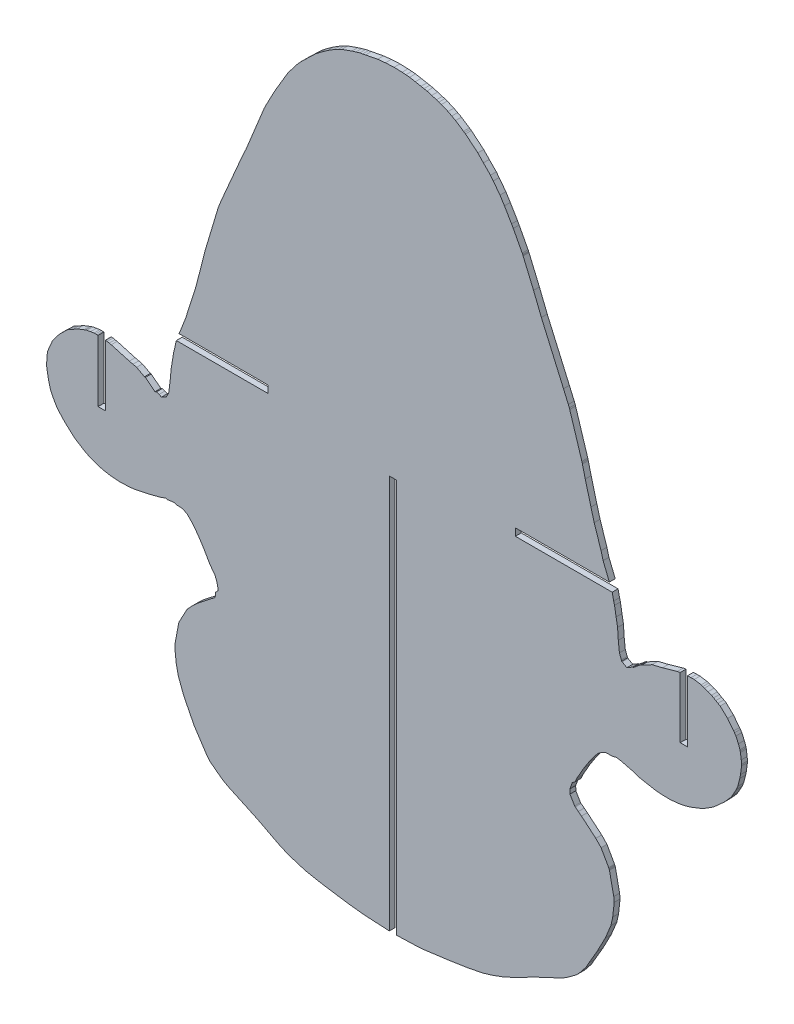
SolidWorks part; units mm, degrees
ref_plane "Спереди" through (0, 0, 0) normal (0, 0, 1) x (1, 0, 0)
ref_plane "Сверху" through (0, 0, 0) normal (0, 1, 0) x (1, 0, 0)
ref_plane "Справа" through (0, 0, 0) normal (1, 0, 0) x (0, 0, -1)
sketch "Model" plane through (0, 0, 0) normal (0, 0, 1) x (1, 0, 0)
  line L0 (-4539.2097, -790.8578) -> (-4543.2316, -789.8734)
  line L1 (-4543.2316, -789.8734) -> (-4543.8733, -789.7726)
  line L2 (-4543.8733, -789.7726) -> (-4544.515, -789.6715)
  line L3 (-4544.515, -789.6715) -> (-4545.1657, -789.8214)
  line L4 (-4545.1657, -789.8214) -> (-4545.8165, -789.9716)
  line L5 (-4545.8165, -789.9716) -> (-4546.9584, -790.0294)
  line L6 (-4546.9584, -790.0294) -> (-4548.1003, -790.0876)
  line L7 (-4548.1003, -790.0876) -> (-4548.5258, -790.1515)
  line L8 (-4548.5258, -790.1515) -> (-4550.4754, -791.2985)
  line L9 (-4550.4754, -791.2985) -> (-4551.1526, -792.0378)
  line L10 (-4551.1526, -792.0378) -> (-4551.8298, -792.7768)
  line L11 (-4551.8298, -792.7768) -> (-4553.8655, -795.6481)
  line L12 (-4553.8655, -795.6481) -> (-4555.4986, -798.1437)
  line L13 (-4555.4986, -798.1437) -> (-4557.9984, -802.5048)
  line L14 (-4557.9984, -802.5048) -> (-4558.2972, -803.1813)
  line L15 (-4558.2972, -803.1813) -> (-4558.596, -803.8581)
  line L16 (-4558.596, -803.8581) -> (-4559.0841, -804.2336)
  line L17 (-4559.0841, -804.2336) -> (-4559.5722, -804.6093)
  line L18 (-4559.5722, -804.6093) -> (-4560.4169, -806.8874)
  line L19 (-4560.4169, -806.8874) -> (-4560.3701, -808.4098)
  line L20 (-4560.3701, -808.4098) -> (-4558.763, -811.1066)
  line L21 (-4558.763, -811.1066) -> (-4558.5805, -811.2975)
  line L22 (-4558.5805, -811.2975) -> (-4557.519, -812.1125)
  line L23 (-4557.519, -812.1125) -> (-4556.4575, -812.9272)
  line L24 (-4556.4575, -812.9272) -> (-4551.5788, -817.047)
  line L25 (-4551.5788, -817.047) -> (-4549.7786, -818.9108)
  line L26 (-4549.7786, -818.9108) -> (-4547.1777, -823.4889)
  line L27 (-4547.1777, -823.4889) -> (-4547.1041, -823.6569)
  line L28 (-4547.1041, -823.6569) -> (-4547.0306, -823.8246)
  line L29 (-4547.0306, -823.8246) -> (-4547.0128, -823.8654)
  line L30 (-4547.0128, -823.8654) -> (-4546.9951, -823.9059)
  line L31 (-4546.9951, -823.9059) -> (-4546.959, -824.0324)
  line L32 (-4546.959, -824.0324) -> (-4546.923, -824.1591)
  line L33 (-4546.923, -824.1591) -> (-4545.4544, -831.1642)
  line L34 (-4545.4544, -831.1642) -> (-4545.301, -832.8083)
  line L35 (-4545.301, -832.8083) -> (-4545.8082, -837.4057)
  line L36 (-4545.8082, -837.4057) -> (-4546.3854, -840.1383)
  line L37 (-4546.3854, -840.1383) -> (-4548.3282, -844.8258)
  line L38 (-4548.3282, -844.8258) -> (-4551.1271, -850.1918)
  line L39 (-4551.1271, -850.1918) -> (-4553.9501, -855.0246)
  line L40 (-4553.9501, -855.0246) -> (-4554.9565, -856.8376)
  line L41 (-4554.9565, -856.8376) -> (-4557.1746, -859.6056)
  line L42 (-4557.1746, -859.6056) -> (-4558.1649, -860.6364)
  line L43 (-4558.1649, -860.6364) -> (-4561.2219, -862.8742)
  line L44 (-4561.2219, -862.8742) -> (-4562.2226, -863.5182)
  line L45 (-4562.2226, -863.5182) -> (-4563.5665, -864.2628)
  line L46 (-4563.5665, -864.2628) -> (-4572.4068, -868.4179)
  line L47 (-4572.4068, -868.4179) -> (-4579.4051, -872.0412)
  line L48 (-4579.4051, -872.0412) -> (-4583.5673, -873.8878)
  line L49 (-4583.5673, -873.8878) -> (-4586.6701, -875.0216)
  line L50 (-4586.6701, -875.0216) -> (-4590.0086, -876.0465)
  line L51 (-4590.0086, -876.0465) -> (-4595.1373, -877.0517)
  line L52 (-4595.1373, -877.0517) -> (-4600.9925, -877.9701)
  line L53 (-4600.9925, -877.9701) -> (-4609.15, -879.049)
  line L54 (-4609.15, -879.049) -> (-4610.9169, -879.2638)
  line L55 (-4610.9169, -879.2638) -> (-4612.9695, -879.3737)
  line L56 (-4612.9695, -879.3737) -> (-4619.0279, -879.5702)
  line L57 (-4619.0279, -879.5702) -> (-4619.3456, -879.5934)
  line L58 (-4619.3456, -879.5934) -> (-4619.4133, -879.5984)
  line L59 (-4619.4133, -879.5984) -> (-4619.4133, -745.3183)
  line L60 (-4619.4133, -745.3183) -> (-4619.6634, -745.3183)
  line L61 (-4619.6634, -745.3183) -> (-4621.6634, -745.3183)
  line L62 (-4621.6634, -745.3183) -> (-4621.9133, -745.3183)
  line L63 (-4621.9133, -745.3183) -> (-4621.9133, -879.5572)
  line L64 (-4621.9133, -879.5572) -> (-4630.3521, -879.0929)
  line L65 (-4630.3521, -879.0929) -> (-4635.1501, -878.5636)
  line L66 (-4635.1501, -878.5636) -> (-4637.3957, -878.2477)
  line L67 (-4637.3957, -878.2477) -> (-4639.6413, -877.932)
  line L68 (-4639.6413, -877.932) -> (-4645.7078, -876.9806)
  line L69 (-4645.7078, -876.9806) -> (-4650.7294, -875.9928)
  line L70 (-4650.7294, -875.9928) -> (-4654.4396, -874.8361)
  line L71 (-4654.4396, -874.8361) -> (-4655.8, -874.3561)
  line L72 (-4655.8, -874.3561) -> (-4657.1605, -873.8764)
  line L73 (-4657.1605, -873.8764) -> (-4658.3128, -873.3708)
  line L74 (-4658.3128, -873.3708) -> (-4659.4651, -872.8654)
  line L75 (-4659.4651, -872.8654) -> (-4666.7346, -869.081)
  line L76 (-4666.7346, -869.081) -> (-4676.6673, -864.4753)
  line L77 (-4676.6673, -864.4753) -> (-4678.3129, -863.5622)
  line L78 (-4678.3129, -863.5622) -> (-4679.6122, -862.6881)
  line L79 (-4679.6122, -862.6881) -> (-4683.022, -860.0951)
  line L80 (-4683.022, -860.0951) -> (-4683.4616, -859.571)
  line L81 (-4683.4616, -859.571) -> (-4683.9012, -859.047)
  line L82 (-4683.9012, -859.047) -> (-4688.2785, -852.4176)
  line L83 (-4688.2785, -852.4176) -> (-4689.7039, -849.6376)
  line L84 (-4689.7039, -849.6376) -> (-4692.0418, -844.9523)
  line L85 (-4692.0418, -844.9523) -> (-4693.7796, -840.3092)
  line L86 (-4693.7796, -840.3092) -> (-4694.4931, -836.9772)
  line L87 (-4694.4931, -836.9772) -> (-4694.973, -832.7043)
  line L88 (-4694.973, -832.7043) -> (-4694.8629, -831.0016)
  line L89 (-4694.8629, -831.0016) -> (-4693.6779, -824.6508)
  line L90 (-4693.6779, -824.6508) -> (-4693.6454, -824.5343)
  line L91 (-4693.6454, -824.5343) -> (-4693.613, -824.4176)
  line L92 (-4693.613, -824.4176) -> (-4693.5715, -824.3302)
  line L93 (-4693.5715, -824.3302) -> (-4693.4359, -823.9987)
  line L94 (-4693.4359, -823.9987) -> (-4691.07, -819.6042)
  line L95 (-4691.07, -819.6042) -> (-4690.8127, -819.0783)
  line L96 (-4690.8127, -819.0783) -> (-4690.1152, -818.3302)
  line L97 (-4690.1152, -818.3302) -> (-4689.4178, -817.5819)
  line L98 (-4689.4178, -817.5819) -> (-4687.2056, -815.477)
  line L99 (-4687.2056, -815.477) -> (-4681.2269, -810.8229)
  line L100 (-4681.2269, -810.8229) -> (-4681.1719, -809.2943)
  line L101 (-4681.1719, -809.2943) -> (-4680.7441, -808.8463)
  line L102 (-4680.7441, -808.8463) -> (-4680.3163, -808.3986)
  line L103 (-4680.3163, -808.3986) -> (-4680.2519, -808.1667)
  line L104 (-4680.2519, -808.1667) -> (-4680.1874, -807.9345)
  line L105 (-4680.1874, -807.9345) -> (-4680.7082, -805.8615)
  line L106 (-4680.7082, -805.8615) -> (-4681.2849, -804.2648)
  line L107 (-4681.2849, -804.2648) -> (-4682.957, -802.0836)
  line L108 (-4682.957, -802.0836) -> (-4685.1479, -798.2858)
  line L109 (-4685.1479, -798.2858) -> (-4687.1816, -795.1496)
  line L110 (-4687.1816, -795.1496) -> (-4689.3422, -792.4276)
  line L111 (-4689.3422, -792.4276) -> (-4690.0955, -791.6798)
  line L112 (-4690.0955, -791.6798) -> (-4690.8487, -790.9323)
  line L113 (-4690.8487, -790.9323) -> (-4691.6077, -790.5685)
  line L114 (-4691.6077, -790.5685) -> (-4692.3666, -790.205)
  line L115 (-4692.3666, -790.205) -> (-4694.4406, -790.0648)
  line L116 (-4694.4406, -790.0648) -> (-4695.4153, -789.7733)
  line L117 (-4695.4153, -789.7733) -> (-4697.5311, -790.1068)
  line L118 (-4697.5311, -790.1068) -> (-4698.1468, -789.9189)
  line L119 (-4698.1468, -789.9189) -> (-4699.4107, -790.4555)
  line L120 (-4699.4107, -790.4555) -> (-4701.2761, -790.946)
  line L121 (-4701.2761, -790.946) -> (-4703.1414, -791.4367)
  line L122 (-4703.1414, -791.4367) -> (-4706.1068, -792.0744)
  line L123 (-4706.1068, -792.0744) -> (-4708.9947, -792.6867)
  line L124 (-4708.9947, -792.6867) -> (-4711.1729, -792.8605)
  line L125 (-4711.1729, -792.8605) -> (-4714.1107, -792.9596)
  line L126 (-4714.1107, -792.9596) -> (-4716.4146, -792.7702)
  line L127 (-4716.4146, -792.7702) -> (-4719.1192, -792.3566)
  line L128 (-4719.1192, -792.3566) -> (-4720.6899, -791.9245)
  line L129 (-4720.6899, -791.9245) -> (-4722.1376, -791.4088)
  line L130 (-4722.1376, -791.4088) -> (-4723.5853, -790.8935)
  line L131 (-4723.5853, -790.8935) -> (-4724.2835, -790.5841)
  line L132 (-4724.2835, -790.5841) -> (-4724.9818, -790.2751)
  line L133 (-4724.9818, -790.2751) -> (-4725.7415, -789.8307)
  line L134 (-4725.7415, -789.8307) -> (-4726.5013, -789.3861)
  line L135 (-4726.5013, -789.3861) -> (-4729.0214, -787.7963)
  line L136 (-4729.0214, -787.7963) -> (-4730.4988, -786.5092)
  line L137 (-4730.4988, -786.5092) -> (-4732.5521, -784.6322)
  line L138 (-4732.5521, -784.6322) -> (-4734.8056, -782.1642)
  line L139 (-4734.8056, -782.1642) -> (-4735.1845, -781.6671)
  line L140 (-4735.1845, -781.6671) -> (-4735.3141, -781.4503)
  line L141 (-4735.3141, -781.4503) -> (-4735.4438, -781.2333)
  line L142 (-4735.4438, -781.2333) -> (-4736.9827, -778.4372)
  line L143 (-4736.9827, -778.4372) -> (-4737.3951, -777.4088)
  line L144 (-4737.3951, -777.4088) -> (-4738.0706, -774.7426)
  line L145 (-4738.0706, -774.7426) -> (-4738.3677, -773.1271)
  line L146 (-4738.3677, -773.1271) -> (-4738.6981, -770.9513)
  line L147 (-4738.6981, -770.9513) -> (-4738.5649, -769.0597)
  line L148 (-4738.5649, -769.0597) -> (-4738.3914, -766.9027)
  line L149 (-4738.3914, -766.9027) -> (-4738.3635, -766.7851)
  line L150 (-4738.3635, -766.7851) -> (-4738.2314, -766.4718)
  line L151 (-4738.2314, -766.4718) -> (-4738.0994, -766.1588)
  line L152 (-4738.0994, -766.1588) -> (-4736.7261, -762.9198)
  line L153 (-4736.7261, -762.9198) -> (-4736.5427, -762.6198)
  line L154 (-4736.5427, -762.6198) -> (-4736.3593, -762.32)
  line L155 (-4736.3593, -762.32) -> (-4734.7241, -760.1786)
  line L156 (-4734.7241, -760.1786) -> (-4734.2527, -759.6584)
  line L157 (-4734.2527, -759.6584) -> (-4733.7813, -759.1378)
  line L158 (-4733.7813, -759.1378) -> (-4731.4046, -756.8715)
  line L159 (-4731.4046, -756.8715) -> (-4730.5877, -756.4313)
  line L160 (-4730.5877, -756.4313) -> (-4729.7708, -755.9909)
  line L161 (-4729.7708, -755.9909) -> (-4728.1934, -755.067)
  line L162 (-4728.1934, -755.067) -> (-4725.9476, -754.1979)
  line L163 (-4725.9476, -754.1979) -> (-4725.4336, -754.0172)
  line L164 (-4725.4336, -754.0172) -> (-4724.9196, -753.8368)
  line L165 (-4724.9196, -753.8368) -> (-4723.7178, -753.6364)
  line L166 (-4723.7178, -753.6364) -> (-4722.5159, -753.4362)
  line L167 (-4722.5159, -753.4362) -> (-4722.0008, -753.4425)
  line L168 (-4722.0008, -753.4425) -> (-4721.4857, -753.4486)
  line L169 (-4721.4857, -753.4486) -> (-4721.1865, -753.446)
  line L170 (-4721.1865, -753.446) -> (-4721.1372, -753.4455)
  line L171 (-4721.1372, -753.4455) -> (-4721.1372, -774.4633)
  line L172 (-4721.1372, -774.4633) -> (-4720.8873, -774.4633)
  line L173 (-4720.8873, -774.4633) -> (-4718.8873, -774.4633)
  line L174 (-4718.8873, -774.4633) -> (-4718.6372, -774.4633)
  line L175 (-4718.6372, -774.4633) -> (-4718.6372, -753.6093)
  line L176 (-4718.6372, -753.6093) -> (-4718.4631, -753.633)
  line L177 (-4718.4631, -753.633) -> (-4718.039, -753.6903)
  line L178 (-4718.039, -753.6903) -> (-4717.342, -753.8302)
  line L179 (-4717.342, -753.8302) -> (-4716.6451, -753.9704)
  line L180 (-4716.6451, -753.9704) -> (-4710.4953, -755.7179)
  line L181 (-4710.4953, -755.7179) -> (-4709.2588, -756.0133)
  line L182 (-4709.2588, -756.0133) -> (-4708.0223, -756.309)
  line L183 (-4708.0223, -756.309) -> (-4705.3383, -757.7563)
  line L184 (-4705.3383, -757.7563) -> (-4705.0314, -757.7939)
  line L185 (-4705.0314, -757.7939) -> (-4701.7507, -760.3795)
  line L186 (-4701.7507, -760.3795) -> (-4701.2244, -760.151)
  line L187 (-4701.2244, -760.151) -> (-4700.371, -760.4977)
  line L188 (-4700.371, -760.4977) -> (-4699.5176, -760.8441)
  line L189 (-4699.5176, -760.8441) -> (-4698.6953, -760.3864)
  line L190 (-4698.6953, -760.3864) -> (-4697.873, -759.9289)
  line L191 (-4697.873, -759.9289) -> (-4697.0792, -758.506)
  line L192 (-4697.0792, -758.506) -> (-4696.5532, -754.2253)
  line L193 (-4696.5532, -754.2253) -> (-4696.2469, -750.9357)
  line L194 (-4696.2469, -750.9357) -> (-4695.8832, -748.6842)
  line L195 (-4695.8832, -748.6842) -> (-4695.3497, -745.4181)
  line L196 (-4695.3497, -745.4181) -> (-4695.1386, -744.6628)
  line L197 (-4695.1386, -744.6628) -> (-4694.481, -741.6415)
  line L198 (-4694.481, -741.6415) -> (-4663.1755, -741.6415)
  line L199 (-4663.1755, -741.6415) -> (-4663.1755, -741.3915)
  line L200 (-4663.1755, -741.3915) -> (-4663.1755, -739.3915)
  line L201 (-4663.1755, -739.3915) -> (-4663.1755, -739.1415)
  line L202 (-4663.1755, -739.1415) -> (-4693.5545, -739.1415)
  line L203 (-4693.5545, -739.1415) -> (-4692.8851, -737.5402)
  line L204 (-4692.8851, -737.5402) -> (-4691.0186, -732.7296)
  line L205 (-4691.0186, -732.7296) -> (-4690.9567, -732.5036)
  line L206 (-4690.9567, -732.5036) -> (-4690.8948, -732.2777)
  line L207 (-4690.8948, -732.2777) -> (-4690.855, -732.0988)
  line L208 (-4690.855, -732.0988) -> (-4690.8152, -731.9196)
  line L209 (-4690.8152, -731.9196) -> (-4688.0716, -723.3866)
  line L210 (-4688.0716, -723.3866) -> (-4687.0738, -719.6225)
  line L211 (-4687.0738, -719.6225) -> (-4685.0301, -711.6564)
  line L212 (-4685.0301, -711.6564) -> (-4684.7387, -710.4464)
  line L213 (-4684.7387, -710.4464) -> (-4684.7178, -710.3693)
  line L214 (-4684.7178, -710.3693) -> (-4684.697, -710.2919)
  line L215 (-4684.697, -710.2919) -> (-4680.4953, -696.2599)
  line L216 (-4680.4953, -696.2599) -> (-4680.1295, -695.1012)
  line L217 (-4680.1295, -695.1012) -> (-4679.2088, -692.7917)
  line L218 (-4679.2088, -692.7917) -> (-4676.2448, -685.8708)
  line L219 (-4676.2448, -685.8708) -> (-4672.0536, -676.1718)
  line L220 (-4672.0536, -676.1718) -> (-4670.7458, -673.3644)
  line L221 (-4670.7458, -673.3644) -> (-4665.4769, -660.4608)
  line L222 (-4665.4769, -660.4608) -> (-4664.9175, -659.0468)
  line L223 (-4664.9175, -659.0468) -> (-4664.5051, -658.0834)
  line L224 (-4664.5051, -658.0834) -> (-4664.0979, -657.2702)
  line L225 (-4664.0979, -657.2702) -> (-4663.6907, -656.4572)
  line L226 (-4663.6907, -656.4572) -> (-4661.2191, -651.7519)
  line L227 (-4661.2191, -651.7519) -> (-4660.931, -651.235)
  line L228 (-4660.931, -651.235) -> (-4660.643, -650.7184)
  line L229 (-4660.643, -650.7184) -> (-4656.9944, -644.5692)
  line L230 (-4656.9944, -644.5692) -> (-4656.6659, -644.0338)
  line L231 (-4656.6659, -644.0338) -> (-4656.3373, -643.4987)
  line L232 (-4656.3373, -643.4987) -> (-4653.4802, -639.7834)
  line L233 (-4653.4802, -639.7834) -> (-4652.3814, -638.5045)
  line L234 (-4652.3814, -638.5045) -> (-4650.8339, -636.9753)
  line L235 (-4650.8339, -636.9753) -> (-4646.9528, -633.2533)
  line L236 (-4646.9528, -633.2533) -> (-4645.3713, -632.0297)
  line L237 (-4645.3713, -632.0297) -> (-4642.9376, -630.2846)
  line L238 (-4642.9376, -630.2846) -> (-4640.7177, -628.8857)
  line L239 (-4640.7177, -628.8857) -> (-4639.3935, -628.2116)
  line L240 (-4639.3935, -628.2116) -> (-4638.0693, -627.5378)
  line L241 (-4638.0693, -627.5378) -> (-4634.6475, -626.32)
  line L242 (-4634.6475, -626.32) -> (-4633.3049, -625.9152)
  line L243 (-4633.3049, -625.9152) -> (-4631.9623, -625.5107)
  line L244 (-4631.9623, -625.5107) -> (-4630.9839, -625.3293)
  line L245 (-4630.9839, -625.3293) -> (-4630.0054, -625.1476)
  line L246 (-4630.0054, -625.1476) -> (-4625.8974, -624.3556)
  line L247 (-4625.8974, -624.3556) -> (-4623.2484, -624.0773)
  line L248 (-4623.2484, -624.0773) -> (-4620.2838, -623.9186)
  line L249 (-4620.2838, -623.9186) -> (-4617.5554, -624.0158)
  line L250 (-4617.5554, -624.0158) -> (-4616.2806, -624.1208)
  line L251 (-4616.2806, -624.1208) -> (-4615.0059, -624.226)
  line L252 (-4615.0059, -624.226) -> (-4613.0689, -624.5822)
  line L253 (-4613.0689, -624.5822) -> (-4611.1319, -624.9386)
  line L254 (-4611.1319, -624.9386) -> (-4610.1076, -625.1349)
  line L255 (-4610.1076, -625.1349) -> (-4609.0833, -625.331)
  line L256 (-4609.0833, -625.331) -> (-4607.4709, -625.8097)
  line L257 (-4607.4709, -625.8097) -> (-4605.8586, -626.2882)
  line L258 (-4605.8586, -626.2882) -> (-4605.0275, -626.5675)
  line L259 (-4605.0275, -626.5675) -> (-4604.1964, -626.8471)
  line L260 (-4604.1964, -626.8471) -> (-4601.9258, -627.7987)
  line L261 (-4601.9258, -627.7987) -> (-4600.6436, -628.4792)
  line L262 (-4600.6436, -628.4792) -> (-4599.3614, -629.1598)
  line L263 (-4599.3614, -629.1598) -> (-4596.6459, -630.9772)
  line L264 (-4596.6459, -630.9772) -> (-4596.3138, -631.2003)
  line L265 (-4596.3138, -631.2003) -> (-4595.9818, -631.4237)
  line L266 (-4595.9818, -631.4237) -> (-4591.7682, -634.9157)
  line L267 (-4591.7682, -634.9157) -> (-4589.8505, -636.9076)
  line L268 (-4589.8505, -636.9076) -> (-4587.4677, -639.3385)
  line L269 (-4587.4677, -639.3385) -> (-4586.508, -640.5729)
  line L270 (-4586.508, -640.5729) -> (-4584.2145, -643.5766)
  line L271 (-4584.2145, -643.5766) -> (-4582.6988, -646.0146)
  line L272 (-4582.6988, -646.0146) -> (-4580.27, -650.1003)
  line L273 (-4580.27, -650.1003) -> (-4579.6823, -651.1569)
  line L274 (-4579.6823, -651.1569) -> (-4576.6409, -656.9206)
  line L275 (-4576.6409, -656.9206) -> (-4576.4949, -657.2243)
  line L276 (-4576.4949, -657.2243) -> (-4576.4107, -657.4196)
  line L277 (-4576.4107, -657.4196) -> (-4576.3265, -657.6151)
  line L278 (-4576.3265, -657.6151) -> (-4572.7773, -665.9823)
  line L279 (-4572.7773, -665.9823) -> (-4570.1166, -672.6515)
  line L280 (-4570.1166, -672.6515) -> (-4562.5698, -689.8996)
  line L281 (-4562.5698, -689.8996) -> (-4560.9267, -693.7157)
  line L282 (-4560.9267, -693.7157) -> (-4560.5915, -694.5536)
  line L283 (-4560.5915, -694.5536) -> (-4560.455, -694.9774)
  line L284 (-4560.455, -694.9774) -> (-4556.3115, -708.1996)
  line L285 (-4556.3115, -708.1996) -> (-4556.2201, -708.549)
  line L286 (-4556.2201, -708.549) -> (-4556.1287, -708.8981)
  line L287 (-4556.1287, -708.8981) -> (-4555.1533, -712.8405)
  line L288 (-4555.1533, -712.8405) -> (-4553.2255, -720.132)
  line L289 (-4553.2255, -720.132) -> (-4552.1135, -724.193)
  line L290 (-4552.1135, -724.193) -> (-4549.7914, -731.2682)
  line L291 (-4549.7914, -731.2682) -> (-4549.0843, -733.9005)
  line L292 (-4549.0843, -733.9005) -> (-4546.9446, -739.1415)
  line L293 (-4546.9446, -739.1415) -> (-4578.9683, -739.1415)
  line L294 (-4578.9683, -739.1415) -> (-4578.9683, -739.3915)
  line L295 (-4578.9683, -739.3915) -> (-4578.9683, -741.3915)
  line L296 (-4578.9683, -741.3915) -> (-4578.9683, -741.6415)
  line L297 (-4578.9683, -741.6415) -> (-4545.9914, -741.6415)
  line L298 (-4545.9914, -741.6415) -> (-4545.4682, -744.0055)
  line L299 (-4545.4682, -744.0055) -> (-4545.1801, -745.1022)
  line L300 (-4545.1801, -745.1022) -> (-4544.6589, -748.2953)
  line L301 (-4544.6589, -748.2953) -> (-4544.1451, -751.1015)
  line L302 (-4544.1451, -751.1015) -> (-4543.9053, -754.7824)
  line L303 (-4543.9053, -754.7824) -> (-4543.5274, -758.3263)
  line L304 (-4543.5274, -758.3263) -> (-4542.8559, -760.0824)
  line L305 (-4542.8559, -760.0824) -> (-4542.7465, -760.4106)
  line L306 (-4542.7465, -760.4106) -> (-4542.6601, -760.4582)
  line L307 (-4542.6601, -760.4582) -> (-4542.5737, -760.5055)
  line L308 (-4542.5737, -760.5055) -> (-4540.9783, -761.4054)
  line L309 (-4540.9783, -761.4054) -> (-4540.0085, -760.8332)
  line L310 (-4540.0085, -760.8332) -> (-4539.0388, -760.2607)
  line L311 (-4539.0388, -760.2607) -> (-4538.9107, -760.2526)
  line L312 (-4538.9107, -760.2526) -> (-4538.7827, -760.2448)
  line L313 (-4538.7827, -760.2448) -> (-4536.3211, -758.2455)
  line L314 (-4536.3211, -758.2455) -> (-4535.9709, -758.1869)
  line L315 (-4535.9709, -758.1869) -> (-4532.3817, -756.2353)
  line L316 (-4532.3817, -756.2353) -> (-4528.8261, -755.369)
  line L317 (-4528.8261, -755.369) -> (-4523.8069, -753.9347)
  line L318 (-4523.8069, -753.9347) -> (-4522.8151, -753.7336)
  line L319 (-4522.8151, -753.7336) -> (-4522.8151, -774.4633)
  line L320 (-4522.8151, -774.4633) -> (-4522.5652, -774.4633)
  line L321 (-4522.5652, -774.4633) -> (-4520.5652, -774.4633)
  line L322 (-4520.5652, -774.4633) -> (-4520.3151, -774.4633)
  line L323 (-4520.3151, -774.4633) -> (-4520.3151, -753.4433)
  line L324 (-4520.3151, -753.4433) -> (-4519.1618, -753.4425)
  line L325 (-4519.1618, -753.4425) -> (-4518.046, -753.4318)
  line L326 (-4518.046, -753.4318) -> (-4515.6766, -753.817)
  line L327 (-4515.6766, -753.817) -> (-4515.0971, -754.0207)
  line L328 (-4515.0971, -754.0207) -> (-4514.5176, -754.2245)
  line L329 (-4514.5176, -754.2245) -> (-4513.343, -754.6789)
  line L330 (-4513.343, -754.6789) -> (-4512.1683, -755.133)
  line L331 (-4512.1683, -755.133) -> (-4511.4391, -755.5597)
  line L332 (-4511.4391, -755.5597) -> (-4510.7099, -755.9867)
  line L333 (-4510.7099, -755.9867) -> (-4509.9571, -756.403)
  line L334 (-4509.9571, -756.403) -> (-4509.2043, -756.8195)
  line L335 (-4509.2043, -756.8195) -> (-4506.69, -759.1911)
  line L336 (-4506.69, -759.1911) -> (-4504.6193, -761.8947)
  line L337 (-4504.6193, -761.8947) -> (-4504.3172, -762.2619)
  line L338 (-4504.3172, -762.2619) -> (-4503.8415, -762.9904)
  line L339 (-4503.8415, -762.9904) -> (-4502.9807, -764.8888)
  line L340 (-4502.9807, -764.8888) -> (-4502.4608, -766.3239)
  line L341 (-4502.4608, -766.3239) -> (-4502.377, -766.6999)
  line L342 (-4502.377, -766.6999) -> (-4502.2932, -767.0756)
  line L343 (-4502.2932, -767.0756) -> (-4502.0186, -769.1413)
  line L344 (-4502.0186, -769.1413) -> (-4501.8937, -770.3595)
  line L345 (-4501.8937, -770.3595) -> (-4501.9167, -770.8629)
  line L346 (-4501.9167, -770.8629) -> (-4502.2753, -773.6059)
  line L347 (-4502.2753, -773.6059) -> (-4502.515, -774.8607)
  line L348 (-4502.515, -774.8607) -> (-4503.2119, -777.5324)
  line L349 (-4503.2119, -777.5324) -> (-4503.6933, -778.7189)
  line L350 (-4503.6933, -778.7189) -> (-4505.0313, -781.109)
  line L351 (-4505.0313, -781.109) -> (-4505.3769, -781.6935)
  line L352 (-4505.3769, -781.6935) -> (-4505.6104, -781.9982)
  line L353 (-4505.6104, -781.9982) -> (-4505.8439, -782.3031)
  line L354 (-4505.8439, -782.3031) -> (-4507.9595, -784.6256)
  line L355 (-4507.9595, -784.6256) -> (-4508.9375, -785.4967)
  line L356 (-4508.9375, -785.4967) -> (-4509.9155, -786.3676)
  line L357 (-4509.9155, -786.3676) -> (-4510.6556, -787.0382)
  line L358 (-4510.6556, -787.0382) -> (-4511.3957, -787.7091)
  line L359 (-4511.3957, -787.7091) -> (-4512.4014, -788.3629)
  line L360 (-4512.4014, -788.3629) -> (-4513.407, -789.0165)
  line L361 (-4513.407, -789.0165) -> (-4514.8088, -789.8734)
  line L362 (-4514.8088, -789.8734) -> (-4516.205, -790.5053)
  line L363 (-4516.205, -790.5053) -> (-4518.9599, -791.5927)
  line L364 (-4518.9599, -791.5927) -> (-4520.157, -791.9538)
  line L365 (-4520.157, -791.9538) -> (-4521.3541, -792.3146)
  line L366 (-4521.3541, -792.3146) -> (-4523.7796, -792.7262)
  line L367 (-4523.7796, -792.7262) -> (-4525.0322, -792.8351)
  line L368 (-4525.0322, -792.8351) -> (-4526.2847, -792.9438)
  line L369 (-4526.2847, -792.9438) -> (-4527.5797, -792.9191)
  line L370 (-4527.5797, -792.9191) -> (-4528.8747, -792.8947)
  line L371 (-4528.8747, -792.8947) -> (-4529.8737, -792.8336)
  line L372 (-4529.8737, -792.8336) -> (-4530.8727, -792.7729)
  line L373 (-4530.8727, -792.7729) -> (-4536.1199, -791.8056)
  line L374 (-4536.1199, -791.8056) -> (-4536.6108, -791.7123)
  line L375 (-4536.6108, -791.7123) -> (-4539.2097, -790.8578)
extrude "Бобышка-Вытянуть1" add sketch "Model" along normal blind 2
